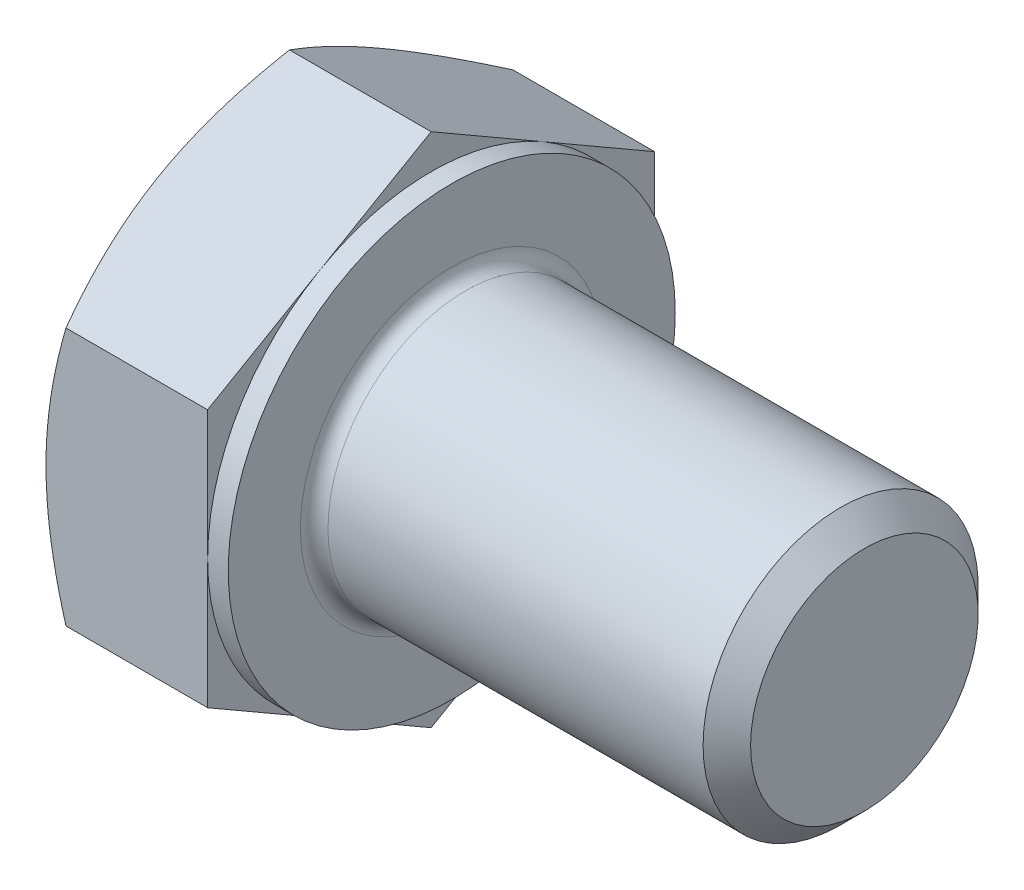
SolidWorks part; units mm, degrees
ref_plane "Plane1" through (0, 0, 0) normal (0, 0, 1) x (1, 0, 0)
ref_plane "Plane2" through (0, 0, 0) normal (0, 1, 0) x (1, 0, 0)
ref_plane "Plane3" through (0, 0, 0) normal (1, 0, 0) x (0, 0, -1)
sketch "Sketch1" plane through (0, 0, 0) normal (1, 0, 0) x (0, 0, -1)
  line L0 (6.5, 3.7528) -> (6.5, -3.7528)
  line L1 (-6.5, 3.7528) -> (-6.5, -3.7528)
  line L2 (6.5, -3.7528) -> (0, -7.5056)
  line L3 (0, -7.5056) -> (-6.5, -3.7528)
  line L4 (6.5, 3.7528) -> (0, 7.5056)
  line L5 (0, 7.5056) -> (-6.5, 3.7528)
  dimension "Width_flats" = 13
  dimension "D2" = 120
  dimension "D3" = 6.5
  dimension "D4" = 6.5
  dimension "D5" = 6.5
extrude "BaseHead" add sketch "Sketch1" along normal blind 5.3
sketch "BodySke" plane through (0, 0, 0) normal (0, 0, 1) x (1, 0, 0)
  line L0 (0, 3.7528) -> (0, -3.7528) construction
  line L1 (0, 0) -> (17.3, 0)
  line L2 (0, 0) -> (0, 4)
  line L3 (0, 4) -> (16.6095, 4)
  line L4 (17.3, 0) -> (17.3, 3.3095)
  line L5 (5.3, 7.5056) -> (5.3, 3.7528) construction
  line L6 (17.3, 3.3095) -> (16.6095, 4)
  line L7 (0, 0) -> (96.52, 0) construction
  line L8 (17.3, -3.3095) -> (16.6095, -4) construction
  line L9 (0, -4) -> (16.6095, -4) construction
  line L10 (6.55, 15.24) -> (6.55, -1.27) construction
  line L11 (7.3, 15.24) -> (7.3, -1.27) construction
  line L12 (5.3, 3.7528) -> (5.3, -3.7528) construction
  dimension "Length" = 12
  dimension "Body_ch_ang" = 45
  dimension "Diameter" = 8
  dimension "Minor_dia" = 6.619
  dimension "Advance" = 1.25
  dimension "Thread_nom" = 10
revolve "BaseBody" add sketch "BodySke"
fillet "HeadFillet" radius 0.4 1 edges at (5.3, 0, -4)
sketch "Sketch3" plane through (0, 0, 0) normal (0, 0, 1) x (1, 0, 0)
  line L0 (0, 6.5) -> (3.4673, 12.5056)
  line L1 (0, 7.5056) -> (0, 3.7528) construction
  line L2 (3.4673, 12.5056) -> (3.4673, 17.5056)
  line L3 (3.4673, 17.5056) -> (-10, 17.5056)
  line L4 (-10, 17.5056) -> (-10, 6.5)
  line L5 (-10, 6.5) -> (0, 6.5)
  line L6 (0, 0) -> (99.06, 0) construction
  line L7 (5.3, 7.5056) -> (0, 7.5056) construction
  dimension "D1" = 6.5
  dimension "D2" = 5
  dimension "D3" = 10
  dimension "D4" = 5
  dimension "Head_ch_ang" = 30
revolve "HeadChamfer" cut sketch "Sketch3" angle 360 about L6
sketch "Sketch4" plane through (0, 0, 0) normal (0, 0, 1) x (1, 0, 0)
  line L1 (5.3, 7.5056) -> (5.3, 3.7528) construction
  line L2 (5.3, 6.5) -> (4.7, 6.5)
  line L3 (5.3, 6.5) -> (5.3, 17.5056)
  line L4 (5.3, 17.5056) -> (4.7, 17.5056)
  line L5 (0, 0) -> (95.25, 0) construction
  line L6 (0, 0) -> (96.52, 0) construction
  line L7 (4.7, 6.5) -> (4.7, 17.5056)
  line L8 (5.3, 7.5056) -> (0.5806, 7.5056) construction
  dimension "D1" = 13
  dimension "D2" = 10
  dimension "Bearing_ht" = 0.6
revolve "BearingFace" cut sketch "Sketch4" angle 360 about L5
sketch "ThdSchSke" plane through (0, 0, 0) normal (0, 0, 1) x (1, 0, 0)
  line L0 (7.3, -3.3095) -> (6.8165, -4)
  line L1 (7.3, -3.3095) -> (7.7835, -4)
  line L2 (7.7835, -4) -> (7.7835, -5)
  line L3 (-3.175, 0) -> (5.1513, 0) construction
  line L5 (7.7835, -5) -> (6.8165, -5)
  line L6 (6.8165, -5) -> (6.8165, -4)
  dimension "Thread_minor" = 6.619
  dimension "Diameter" = 8
  dimension "Start" = 7.3
  dimension "SideAngle" = 55
  dimension "VeeAngle" = 70
  dimension "Overcut" = 10
revolve "ThreadSchematic" [suppressed] cut sketch "ThdSchSke" angle 360 about L3
pattern_linear "ThdSchPat" [suppressed]
equation "\"D3@Sketch1\" = \"Width_flats@Sketch1\" / 2"
equation "\"D4@Sketch1\" = \"D3@Sketch1\""
equation "\"D5@Sketch1\" = \"D4@Sketch1\""
equation "\"Thread_minor@ThreadCosmetic\" = \"Minor_dia@BodySke\""
equation "\"D1@Sketch3\" = \"Width_flats@Sketch1\" / 2"
equation "\"D1@Sketch4\" = \"Width_flats@Sketch1\""
equation "\"Thread_length@ThreadCosmetic\" = ((sgn( (\"Length@BodySke\" - \"Advance@BodySke\" ) - \"Thread_nom@BodySke\" )-1)*( (\"Length@BodySke\" - \"Advance@BodySke\" ) - \"Thread_nom@BodySke\" ))/-2+ \"Thread_nom@BodySke\""
equation "\"Thread_minor@ThdSchSke\" = \"Minor_dia@BodySke\""
equation "\"Diameter@ThdSchSke\" = \"Diameter@BodySke\""
equation "\"Overcut@ThdSchSke\" = \"Diameter@BodySke\" * 1.25"
equation "\"Start@ThdSchSke\" = \"Head_ht@BaseHead\" + \"Length@BodySke\" - \"Thread_length@ThreadCosmetic\"  '---Non-countersunk---"
equation "\"Num_threads@ThdSchPat\" = int( \"Thread_length@ThreadCosmetic\" / \"Advance@BodySke\" + 0.999 )  + 1"
equation "\"Advance@ThdSchPat\" = \"Thread_length@ThreadCosmetic\" /  (\"Num_threads@ThdSchPat\" - 1) 'relax it"
equation "\"Num_threads@ThdSchPat\" = \"Num_threads@ThdSchPat\" - sgn( \"Num_threads@ThdSchPat\" - 1) '---chamfered tips only---"
